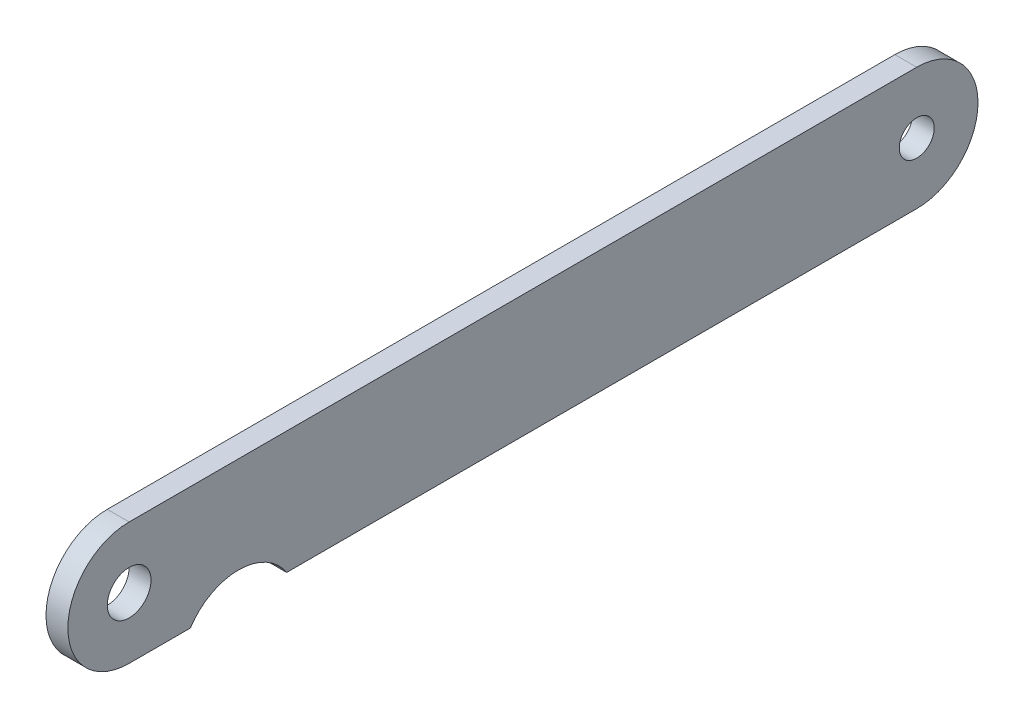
SolidWorks part; units mm, degrees
ref_plane "Front" through (0, 0, 0) normal (0, 0, 1) x (1, 0, 0)
ref_plane "Top" through (0, 0, 0) normal (0, 1, 0) x (1, 0, 0)
ref_plane "Right" through (0, 0, 0) normal (1, 0, 0) x (0, 0, -1)
sketch "Sketch1"
  dimension "D1" = 90
  dimension "D2" = 14
extrude "Extrude1" add sketch "Sketch1" along normal blind 2.5
sketch "Sketch2"
  dimension "D1" = 11
  dimension "D2" = 7
  dimension "D3" = 3
extrude "Cut-Extrude1" cut sketch "Sketch2" against normal blind 2.5
sketch "Sketch3"
hole_wizard "M4.0 (4) Diameter Hole1" positions "3DSketch1" profile "Sketch4" hole size "M4.0" standard "Ansi Metric"
sketch3d "3DSketch1"
sketch "Sketch4"
  dimension "Thru Hole Dia." = 4
  dimension "Thru Hole Depth" = 2.5
hole_wizard "M5.0 (5) Diameter Hole1" positions "3DSketch2" profile "Sketch5" hole size "M5.0" standard "Ansi Metric"
sketch3d "3DSketch2"
sketch "Sketch5"
  dimension "Thru Hole Dia." = 5
  dimension "Thru Hole Depth" = 2.5
